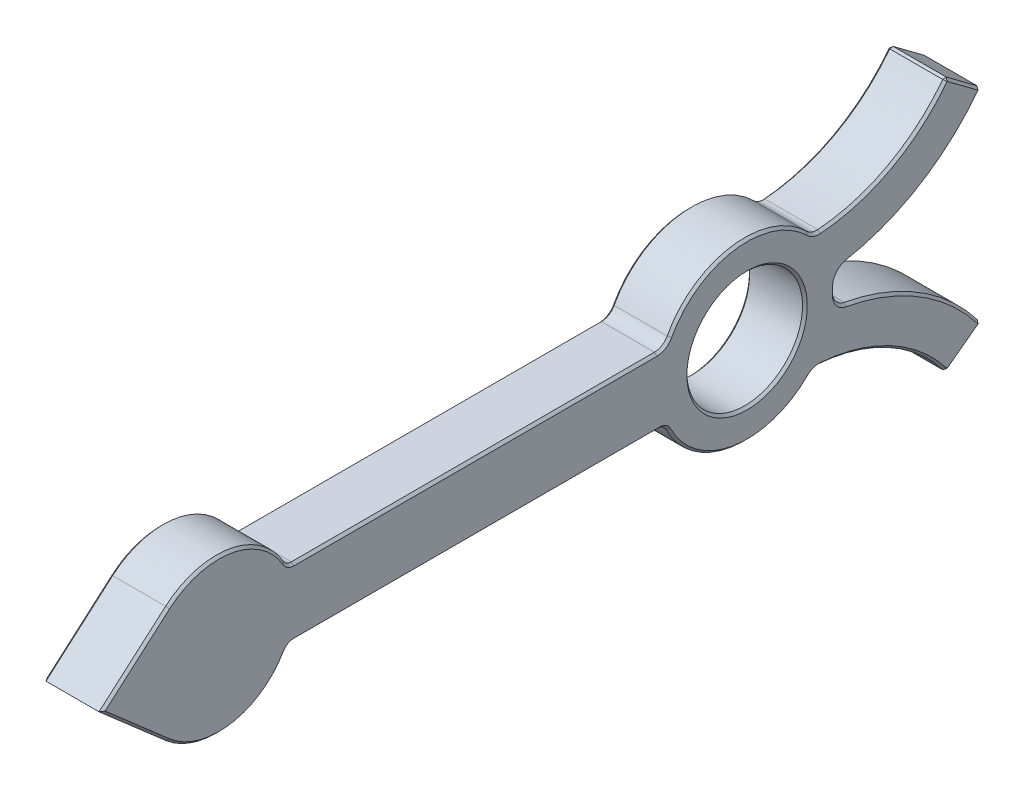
SolidWorks part; units mm, degrees
ref_plane "Спереди" through (0, 0, 0) normal (0, 0, 1) x (1, 0, 0)
ref_plane "Сверху" through (0, 0, 0) normal (0, 1, 0) x (1, 0, 0)
ref_plane "Справа" through (0, 0, 0) normal (1, 0, 0) x (0, 0, -1)
sketch "Эскиз1" plane through (0, 0, 0) normal (1, 0, 0) x (0, 0, -1)
  line L0 (0, 0) -> (-67, 0) construction
  line L1 (-60.0894, 6.0285) -> (-67, 0)
  line L2 (-67, 0) -> (-60.0894, -6.0285)
  line L3 (-47.0362, 3.5) -> (-9.3693, 3.5)
  line L4 (-47.0362, -3.5) -> (-9.0645, -3.5)
  line L5 (20.702, 13.2427) -> (24.31, 10.5534)
  line L6 (0, 0) -> (6.27, 0) construction
  line L7 (0, 0) -> (0, 24) construction
  line L8 (0, 24) -> (6.27, 24) construction
  line L9 (6.27, 0) -> (6.27, 24) construction
  line L10 (20.702, -13.2427) -> (24.31, -10.5534)
  circle A0 centre (0, 0) radius 6
  arc A1 (-8.1688, -4.0553) -> (6.419, -6.4785) centre (0, 0) ccw
  arc A2 (-60.0894, -6.0285) -> (-47.9022, -4) centre (-54.8304, 0) ccw
  arc A3 (-47.9022, 4) -> (-60.0894, 6.0285) centre (-54.8304, 0) ccw
  arc A4 (-9.0645, -3.5) -> (-8.1688, -4.0553) centre (-9.0645, -4.5) cw
  arc A5 (-9.3693, 3.5) -> (-8.046, 4.2938) centre (-9.3693, 5) ccw
  arc A6 (-47.0362, -3.5) -> (-47.9022, -4) centre (-47.0362, -4.5) ccw
  arc A7 (-47.0362, 3.5) -> (-47.9022, 4) centre (-47.0362, 4.5) cw
  arc A8 (10.3412, 1.8714) -> (24.31, 10.5534) centre (6.27, 24) ccw
  arc A9 (7.5843, 6.048) -> (20.702, 13.2427) centre (6.27, 24) ccw
  circle A10 centre (6.27, 24) radius 18 construction
  circle A11 centre (6.27, 24) radius 22.5 construction
  arc A12 (6.419, 6.4785) -> (-8.046, 4.2938) centre (0, 0) ccw
  arc A13 (10.3412, -1.8714) -> (24.31, -10.5534) centre (6.27, -24) cw
  arc A14 (7.5843, -6.048) -> (20.702, -13.2427) centre (6.27, -24) cw
  arc A15 (9.1137, -0.3402) -> (9.1137, 0.3402) centre (0, 0) ccw
  arc A16 (10.3412, 1.8714) -> (9.1137, 0.3402) centre (10.6126, 0.3961) ccw
  arc A17 (10.3412, -1.8714) -> (9.1137, -0.3402) centre (10.6126, -0.3961) cw
  arc A18 (7.5843, -6.048) -> (6.419, -6.4785) centre (7.4747, -7.544) ccw
  arc A19 (7.5843, 6.048) -> (6.419, 6.4785) centre (7.4747, 7.544) cw
  point P13 (-8.4217, -3.5)
  point P16 (-8.4217, 3.5)
  point P19 (-47.6366, -3.5)
  point P22 (-47.6366, 3.5)
  point P40 (8.9672, 1.6623)
  point P43 (8.9672, -1.6623)
  point P46 (6.8599, -6.0097)
  point P49 (6.8599, 6.0097)
  dimension "D1" = 12
  dimension "D2" = 18.24
  dimension "D4" = 16
  dimension "D7" = 1
  dimension "D8" = 1.5
  dimension "D9" = 1
  dimension "D10" = 1
  dimension "D13" = 45
  dimension "D16" = 1.5
  dimension "D17" = 1.5
  dimension "D18" = 1.5
  dimension "D19" = 1.5
  dimension "D3" = 67
  dimension "D5" = 82.2
  dimension "D6" = 7
  dimension "D11" = 6.27
  dimension "D12" = 24
  dimension "D15" = 53.3
  dimension "D14" = 4.5
extrude "Бобышка-Вытянуть1" add sketch "Эскиз1" along normal blind 6
chamfer "Фаска1" distance 0.25 angle 45 52 edges at (0, 0, -6) (6, 0, -6) (3, -13.2427, -20.702) (3, -10.5534, -24.31) (3, 10.5534, -24.31) (0, -8.9967, 1.4944) (0, -6.137, -6.955) (0, -8.2179, -14.926) (0, -11.8981, -22.506) (0, -4.8903, -18.1473) (0, -1.3344, -9.4423) (0, 0, -9.12) (0, 1.3344, -9.4423) (0, 4.8903, -18.1473) (0, 11.8981, -22.506) (0, -3.6501, 8.5375) (0, -3.5, 28.0503) (0, -3.634, 47.5362) (0, -7.8914, 53.5169) (0, -3.0143, 63.5447) (0, 3.0143, 63.5447) (0, 7.8914, 53.5169) (0, 3.634, 47.5362) (0, 3.5, 28.2027) (0, 3.7137, 8.5978) (0, 9.0177, 1.362) (0, 6.137, -6.955) (0, 8.2179, -14.926) (3, 13.2427, -20.702) (6, -3.5, 28.0503) (6, -3.634, 47.5362) (6, -7.8914, 53.5169) (6, -3.0143, 63.5447) (6, 3.0143, 63.5447) (6, 7.8914, 53.5169) (6, 3.634, 47.5362) (6, 3.5, 28.2027) (6, 3.7137, 8.5978) (6, 9.0177, 1.362) (6, 6.137, -6.955) (6, 8.2179, -14.926) (6, 11.8981, -22.506) (6, 4.8903, -18.1473) (6, 1.3344, -9.4423) (6, 0, -9.12) (6, -1.3344, -9.4423) (6, -4.8903, -18.1473) (6, -11.8981, -22.506) (6, -8.2179, -14.926) (6, -6.137, -6.955) (6, -8.9967, 1.4944) (6, -3.6501, 8.5375)
